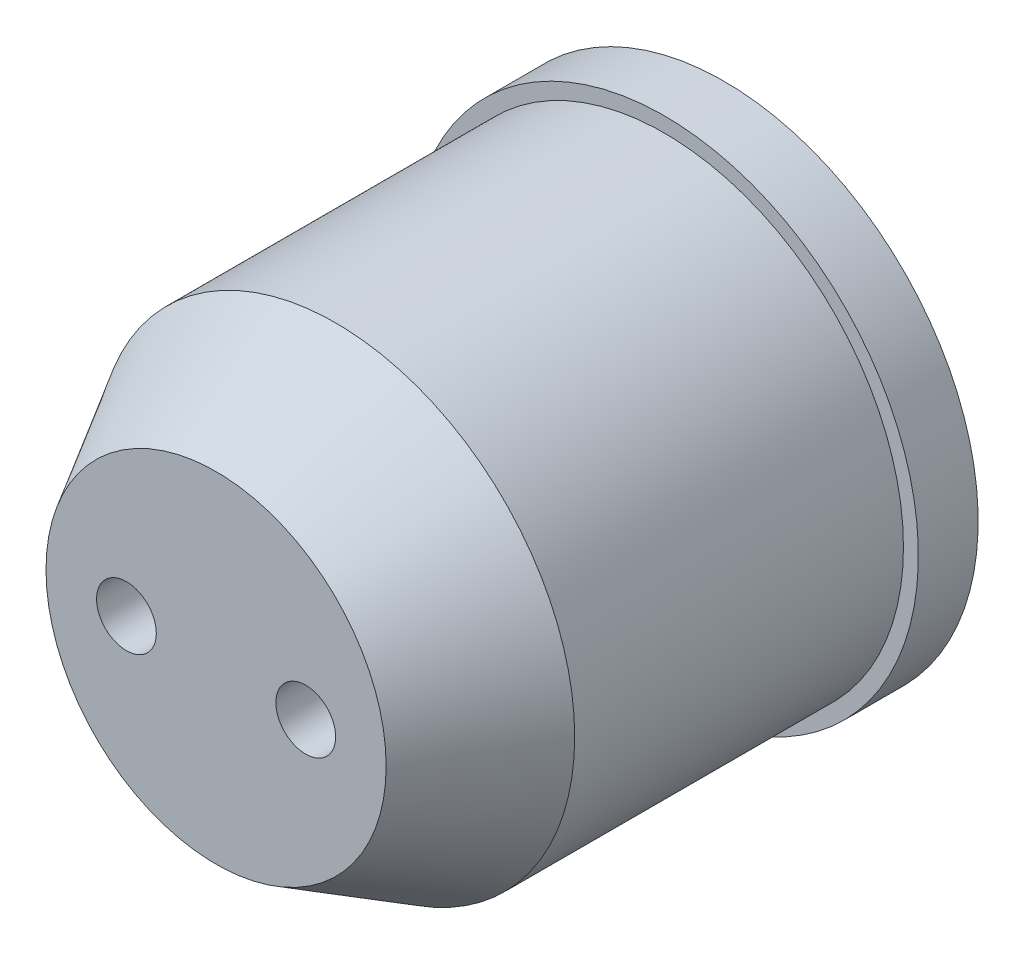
SolidWorks part; units mm, degrees
ref_plane "Plan1" through (0, 0, 0) normal (0, 0, 1) x (1, 0, 0)
ref_plane "Plan2" through (0, 0, 0) normal (0, 1, 0) x (1, 0, 0)
ref_plane "Plan3" through (0, 0, 0) normal (1, 0, 0) x (0, 0, -1)
sketch "Esquisse1" plane through (0, 0, 0) normal (0, 0, 1) x (1, 0, 0)
  circle A0 centre (0, 0) radius 4
  dimension "D1" = 8
extrude "Base-Extrusion" add sketch "Esquisse1" along normal blind 7.5
chamfer "Chanfrein1" distance 2 angle 30
sketch "Esquisse4" plane through (0, 0, 0) normal (0, 0, -1) x (-1, 0, 0)
  circle A0 centre (0, 0) radius 2.5
  dimension "D1" = 5
extrude "Enlèv. mat.-Extru.1" cut sketch "Esquisse4" against normal blind 5
sketch "Esquisse6" plane through (0, 0, 7.5) normal (0, 0, 1) x (1, 0, 0)
  circle A0 centre (1.5, 0) radius 0.5
  circle A1 centre (-1.5, 0) radius 0.5
  dimension "D1" = 3
  dimension "D2" = 1.5
extrude "Enlèv. mat.-Extru.2" cut sketch "Esquisse6" against normal through all
sketch "Esquisse7" plane through (0, 0, 0) normal (0, 0, -1) x (-1, 0, 0)
  circle A0 centre (0, 0) radius 4.25
  dimension "D1" = 8.5
extrude "Boss.-Extru.2" add sketch "Esquisse7" along normal blind 1
sketch "Esquisse8" plane through (0, 0, -1) normal (0, 0, -1) x (-1, 0, 0)
  circle A0 centre (0, 0) radius 2.5
  dimension "D1" = 5
extrude "Enlèv. mat.-Extru.3" cut sketch "Esquisse8" against normal up to next
